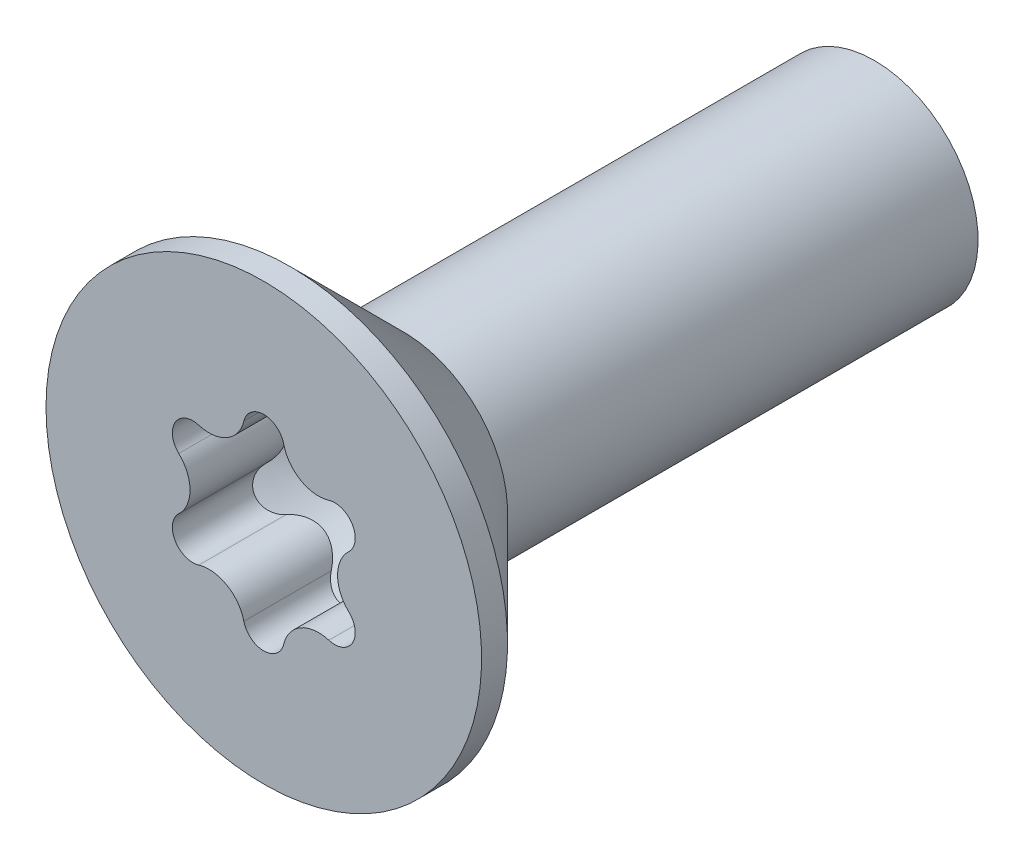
SolidWorks part; units mm, degrees
ref_plane "Front Plane" through (0, 0, 0) normal (0, 0, 1) x (1, 0, 0)
ref_plane "Top Plane" through (0, 0, 0) normal (0, 1, 0) x (1, 0, 0)
ref_plane "Right Plane" through (0, 0, 0) normal (1, 0, 0) x (0, 0, -1)
sketch "BodySke"
revolve "Base-Revolve" add sketch "BodySke" angle 360 about L0
sketch "PreBSke"
revolve "PreBroach" cut sketch "PreBSke" angle 360 about L0
sketch "HexSke"
extrude "Hexalobular" add sketch "HexSke" against normal up to next
sketch "ThdSchSke"
revolve "ThreadSchematic" cut sketch "ThdSchSke" angle 360 about L6
ref_plane "ThreadPlane" through (0, 0, -2.7) normal (0, 0, -1) x (-1, 0, 0)
pattern_linear "ThdSchPat" [suppressed] count 11
equation "\"MinorDia@ThreadCosmetic\" = \"MinorDia@ThdSchSke\""
equation "\"ThdLen@ThreadCosmetic\" = \"ThreadLength\""
equation "\"Ri@HexSke\"= .1 * \"A@PreBSke\""
equation "\"Re@HexSke\"= .175 * \"A@PreBSke\""
equation "\"ThreadLength\"= IIF ( \"B@BodySke\" = \"L@BodySke\" , \"L@BodySke\" - \"K@BodySke\" , \"B@BodySke\" )"
equation "\"ThdLen@ThreadPlane\"=\"ThreadLength\""
